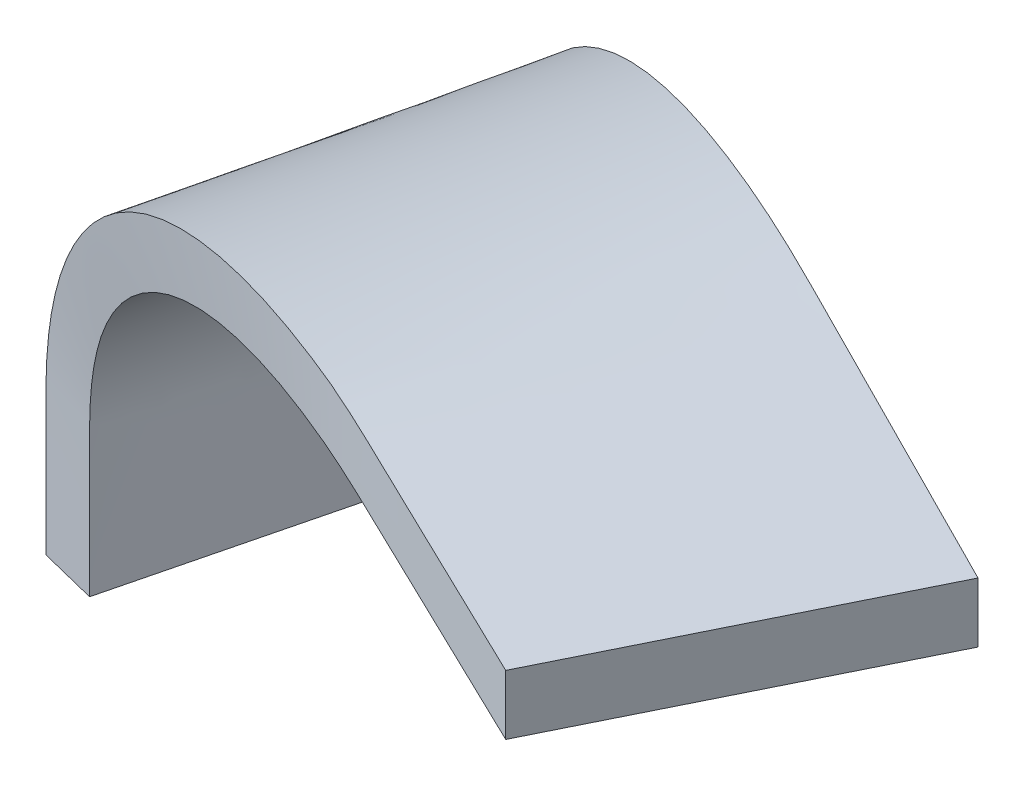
SolidWorks part; units mm, degrees
other "<Strap_left_&>-<Fillet1>"
ref_plane "Front Plane" through (0, 0, 0) normal (0, 0, 1) x (1, 0, 0)
ref_plane "Top Plane" through (0, 0, 0) normal (0, 1, 0) x (1, 0, 0)
ref_plane "Right Plane" through (0, 0, 0) normal (1, 0, 0) x (0, 0, -1)
mirrored part "Strap_left_&_Mirrored"
